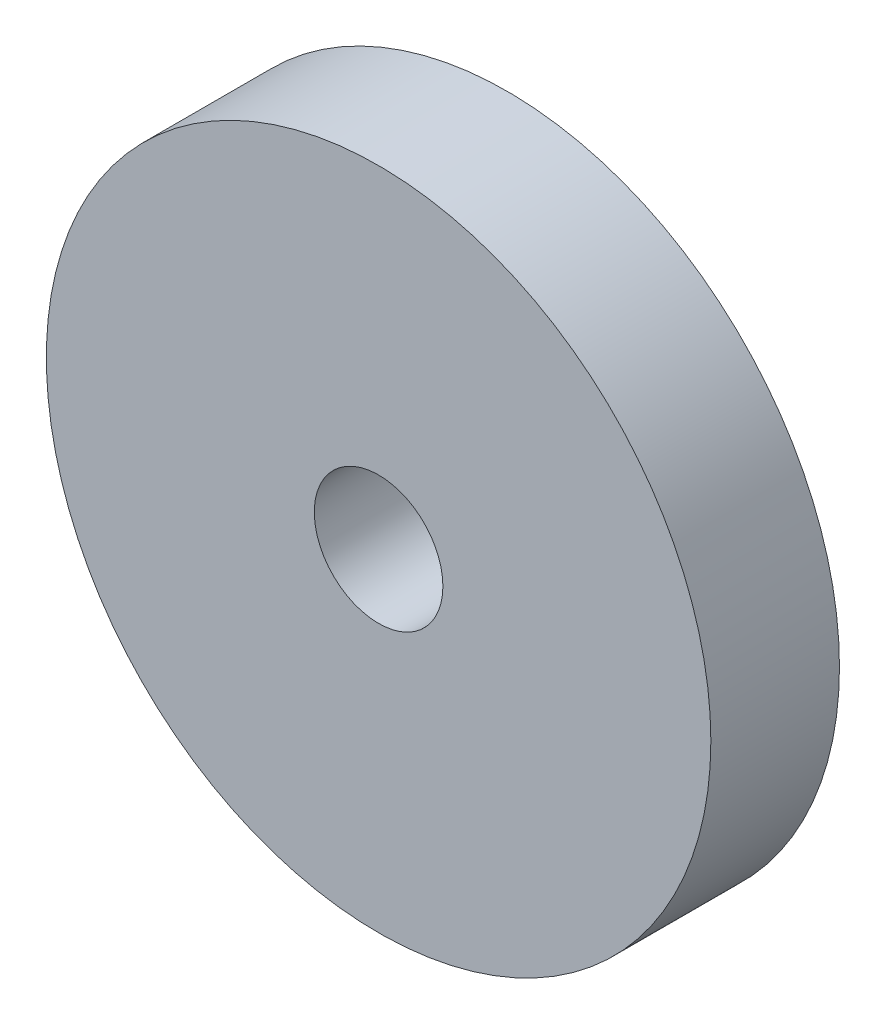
SolidWorks part; units mm, degrees
ref_plane "Front Plane" through (0, 0, 0) normal (0, 0, 1) x (1, 0, 0)
ref_plane "Top Plane" through (0, 0, 0) normal (0, 1, 0) x (1, 0, 0)
ref_plane "Right Plane" through (0, 0, 0) normal (1, 0, 0) x (0, 0, -1)
sketch "Sketch1" plane through (0, 0, 0) normal (0, 0, 1) x (1, 0, 0)
  circle A0 centre (0, 0) radius 15.5
  circle A1 centre (0, 0) radius 3
  dimension "D1" = 31
  dimension "D2" = 6
extrude "Boss-Extrude1" add sketch "Sketch1" along normal blind 6
